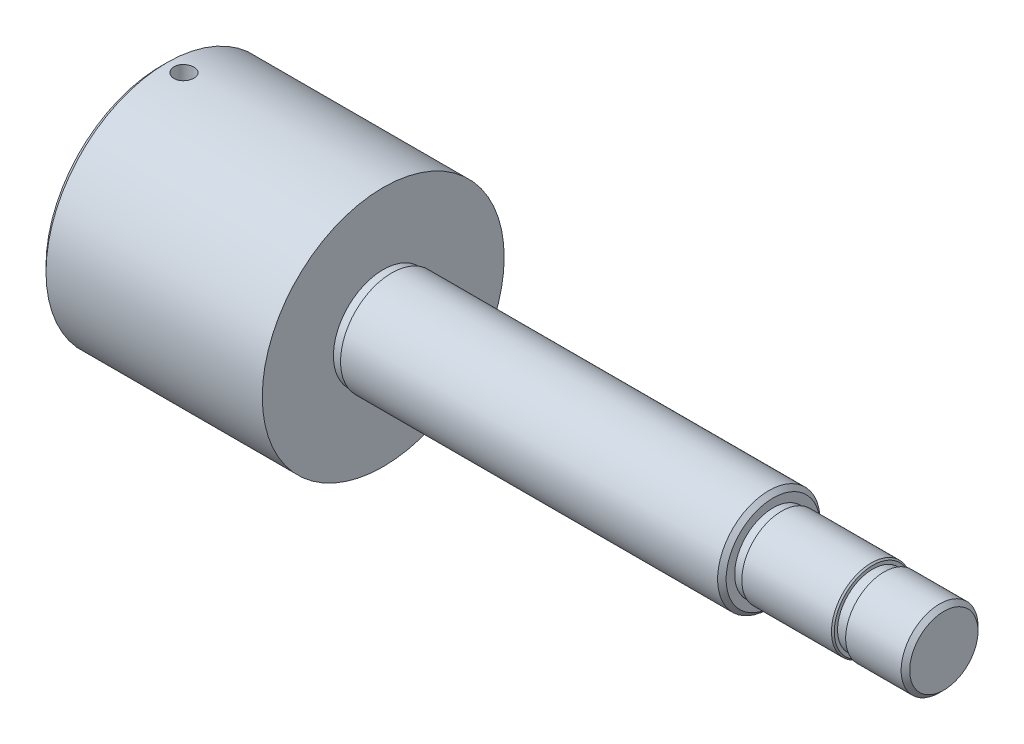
SolidWorks part; units mm, degrees
ref_plane "前视基准面" through (0, 0, 0) normal (0, 0, 1) x (1, 0, 0)
ref_plane "上视基准面" through (0, 0, 0) normal (0, 1, 0) x (1, 0, 0)
ref_plane "右视基准面" through (0, 0, 0) normal (1, 0, 0) x (0, 0, -1)
sketch "草图1" plane through (0, 0, 0) normal (0, 0, 1) x (1, 0, 0)
  line L0 (0, 33) -> (14, 33)
  line L1 (14, 33) -> (14, 34.25)
  line L2 (14, 34.25) -> (18, 34.25)
  line L3 (18, 34.25) -> (18, 31)
  line L4 (18, 31) -> (53, 31)
  line L5 (53, 31) -> (53, 22.5)
  line L6 (53, 22.5) -> (71, 22.5)
  line L7 (71, 22.5) -> (71, 0)
  line L8 (0, 33) -> (0, 42.5)
  line L9 (0, 42.5) -> (78, 42.5)
  line L10 (78, 42.5) -> (78, 17.5)
  line L11 (78, 17.5) -> (81, 17.5)
  line L12 (81, 17.5) -> (81, 18)
  line L13 (81, 18) -> (215, 18)
  line L14 (215, 18) -> (215, 14)
  line L15 (218, 14) -> (250, 14)
  line L16 (215, 14) -> (215, 13.5)
  line L17 (215, 13.5) -> (218, 13.5)
  line L18 (250, 14) -> (250, 12.35)
  line L19 (0, 0) -> (-24.7239, 0) construction
  line L20 (71, 0) -> (275, 0)
  line L21 (254, 13.5) -> (275, 13.5)
  line L22 (275, 13.5) -> (275, 0)
  line L23 (218, 13.5) -> (218, 14)
  line L25 (250, 12.35) -> (254, 12.35)
  line L26 (254, 12.35) -> (254, 13.5)
  dimension "D1" = 66
  dimension "D2" = 68.5
  dimension "D3" = 62
  dimension "D4" = 45
  dimension "D5" = 85
  dimension "D6" = 78
  dimension "D7" = 71
  dimension "D8" = 18
  dimension "D9" = 4
  dimension "D10" = 53
  dimension "D11" = 36
  dimension "D12" = 0.5
  dimension "D13" = 275
  dimension "D14" = 27
  dimension "D15" = 3
  dimension "D16" = 25
  dimension "D17" = 28
  dimension "D18" = 60
  dimension "D19" = 0.5
  dimension "D20" = 3
  dimension "D21" = 4
  dimension "D22" = 24.7
revolve "旋转1" add sketch "草图1" angle 360 about L19
chamfer "倒角6" distance 2 angle 45 1 edges at (0, 0, -33)
chamfer "倒角1" distance 1.5 angle 45 2 edges at (215, 0, -18) (275, 0, -13.5)
chamfer "倒角4" distance 2 angle 45 1 edges at (0, 0, -42.5)
hole_wizard "M8x1.0 螺纹孔1" positions "草图9" profile "草图8" tap size "M8x1.0" standard "Ansi Metric"
sketch "草图9" plane through (0, 0, 0) normal (0, 1, 0) x (1, 0, 0)
  line L0 (0, 40.5) -> (0, -40.5) construction
  point P1 (8, 0)
  dimension "D1" = 8
sketch "草图8" plane through (8, 0, 0) normal (1, 0, 0) x (0, 0, -1)
  line L0 (0, 0) -> (0, 42.5)
  line L1 (0, 42.5) -> (3.5, 42.5)
  line L2 (3.5, 42.5) -> (3.5, 0)
  line L5 (3.5, 0) -> (0, 0)
  line L11 (0, -6.35) -> (0, 107.95) construction
  dimension "籵謂蹟恇謂郰芛眻噤" = 7
  dimension "籵謂蹟恇謂郰芛旮僅" = 42.5
mirror "镜向1" about plane through (0, 0, 0) normal (0, 1, 0) of "M8x1.0 螺纹孔1"
chamfer "倒角5" distance 0.5 angle 45 1 edges at (250, 0, -14)
sketch "草图11" plane through (0, 0, 0) normal (0, 0, 1) x (1, 0, 0)
  spline S0 degree 3 poles (-2.3494, 80.9164) (73.2757, 84.3348) (68.6024, 45.2069) (76.5994, 28.3831) (73.7312, 15.7008) (74.0488, -2.5711) (77.552, -19.2466) (73.8063, -36.5049) (77.7679, -76.4101) (-34.5699, -87.3791) (-56.2227, 24.6934) (-2.3494, 80.9164) (73.2757, 84.3348) (68.6024, 45.2069) knots -0.521489 -0.291193 -0.126352 0 0.080958 0.09299 0.128321 0.165698 0.221482 0.243079 0.288551 0.478511 0.708807 0.873648 1 1.080958 1.09299 1.128321 only from (65.2103, 70.3069) to (65.2103, 70.3069)
extrude "切除-拉伸2" cut sketch "草图11" along normal through all
